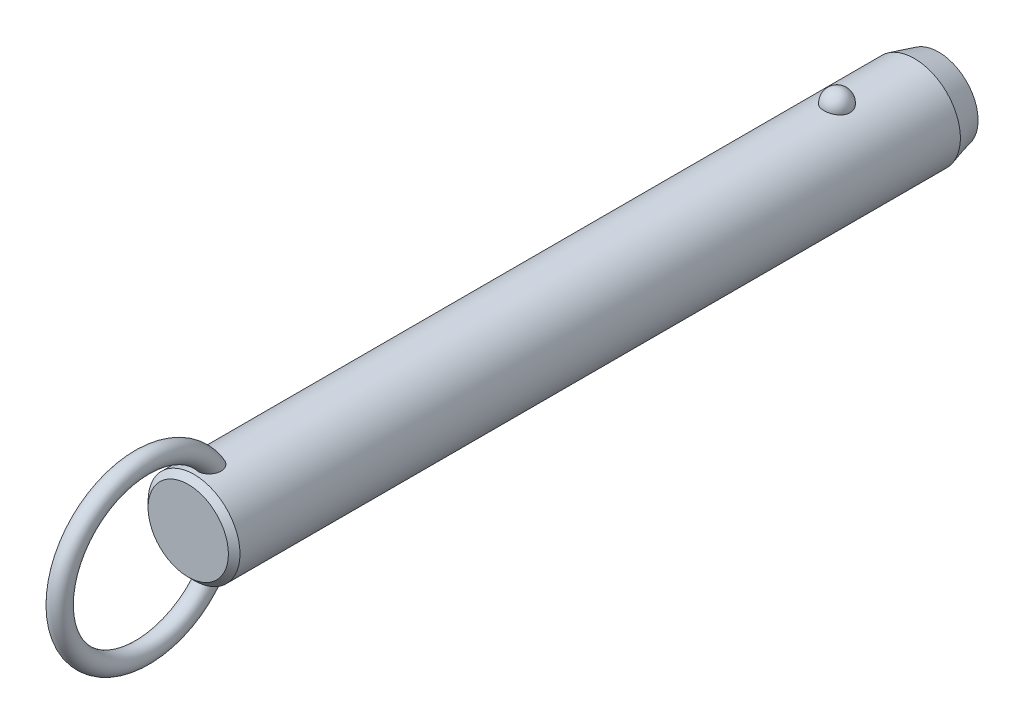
SolidWorks part; units mm, degrees
ref_plane "Front Plane" through (0, 0, 0) normal (0, 0, 1) x (1, 0, 0)
ref_plane "Top Plane" through (0, 0, 0) normal (0, 1, 0) x (1, 0, 0)
ref_plane "Right Plane" through (0, 0, 0) normal (1, 0, 0) x (0, 0, -1)
sketch "Sketch2" plane through (0, 0, 0) normal (0, 0, 1) x (1, 0, 0)
  circle A0 centre (0, 0) radius 9.5
  point P3 (0, 9.5)
  dimension "D1" = 19
extrude "Boss-Extrude1" add sketch "Sketch2" along normal blind 121.9
sketch "Sketch3" plane through (0, 0, 0) normal (0, 0, -1) x (-1, 0, 0)
  circle A0 centre (0, 0) radius 9.5
  dimension "D1" = 19
extrude "Boss-Extrude2" add sketch "Sketch3" along normal blind 23.7
chamfer "Chamfer1" distance 5 angle 15 1 edges at (-9.5, 0, -23.7)
sketch "Sketch12" plane through (0, 0, 0) normal (1, 0, 0) x (0, 0, -1)
  line L0 (-121.9, 9.5) -> (-121.9, -9.5) construction
  point P0 (-121.9, 0)
sketch "Sketch13" plane through (0, 0, 0) normal (1, 0, 0) x (0, 0, -1)
  circle A0 centre (-140.95, 0) radius 19.05
  point P2 (-121.9, 0)
  dimension "D1" = 38.1
sketch "Sketch14" plane through (0, 0, 0) normal (0, 1, 0) x (1, 0, 0)
  circle A0 centre (0, -123.9) radius 2
  point P2 (0, -121.9)
  dimension "D1" = 4
sweep "Sweep1" add profiles "Sketch14" path "Sketch13"
sketch "Sketch15" plane through (0, 0, 121.9) normal (0, 0, 1) x (1, 0, 0)
  circle A0 centre (0, 0) radius 9.5
  dimension "D1" = 19
extrude "Boss-Extrude3" add sketch "Sketch15" along normal blind 9.52
chamfer "Chamfer2" distance 1.2 angle 45 1 edges at (9.5, 0, 131.42)
sketch "Sketch18" plane through (0, 0, 0) normal (1, 0, 0) x (0, 0, -1)
  line L0 (18.7, 9.5) -> (-124.4378, 9.5) construction
  line L1 (2.7, 12.2) -> (2.7, 6.8)
  line L2 (-124.4378, -9.5) -> (18.7, -9.5) construction
  arc A0 (2.7, 12.2) -> (2.7, 6.8) centre (2.7, 9.5) ccw
  point P4 (0, 9.5)
  dimension "D1" = 21.7
revolve "Revolve1" add sketch "Sketch18" angle 360 about L1
